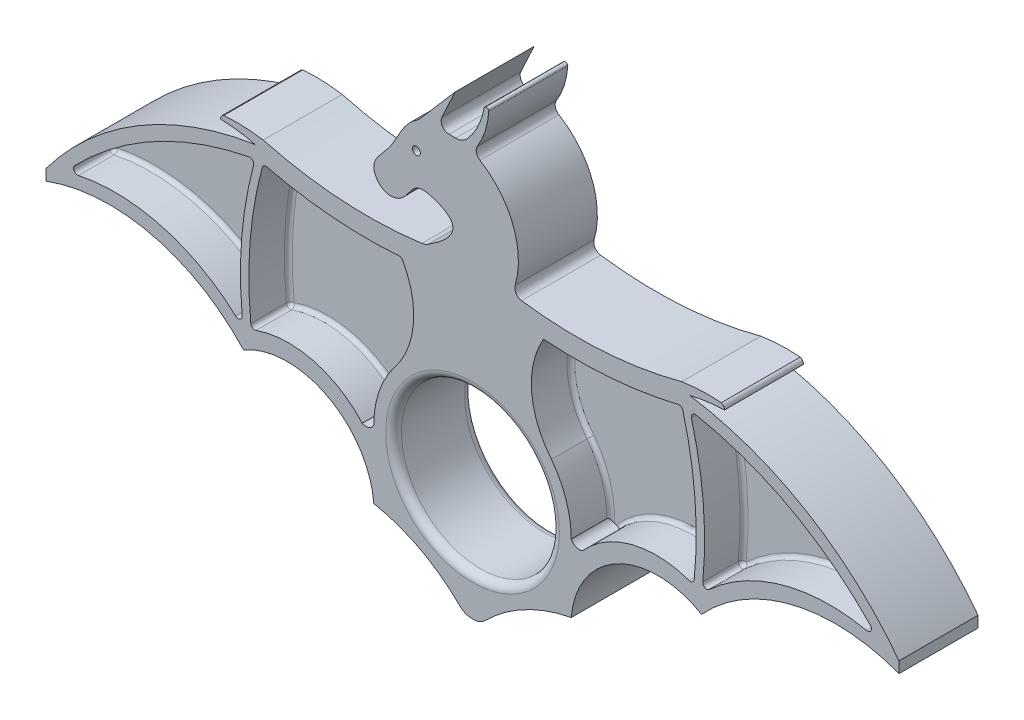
SolidWorks part; units mm, degrees
ref_plane "Front Plane" through (0, 0, 0) normal (0, 0, 1) x (1, 0, 0)
ref_plane "Top Plane" through (0, 0, 0) normal (0, 1, 0) x (1, 0, 0)
ref_plane "Right Plane" through (0, 0, 0) normal (1, 0, 0) x (0, 0, -1)
sketch "Sketch1" plane through (0, 0, 0) normal (0, 0, 1) x (1, 0, 0)
  line L0 (68.58, 0) -> (68.58, 76.2)
  line L1 (0, 0) -> (137.16, 0)
  line L2 (0, 0) -> (0, 76.2)
  line L3 (0, 76.2) -> (137.16, 76.2)
  line L4 (137.16, 0) -> (137.16, 76.2)
  line L5 (84.455, 19.05) -> (84.455, 0)
  line L6 (105.41, 76.2) -> (105.41, 0)
  line L7 (59.8445, 65.0965) -> (65.786, 71.9835)
  line L8 (103.505, 46.5545) -> (102.235, 46.5545)
  line L9 (103.505, 46.5545) -> (103.505, 48.5865)
  line L10 (103.505, 48.5865) -> (102.235, 48.5865)
  line L11 (102.235, 46.5545) -> (102.235, 48.5865)
  line L12 (102.235, 48.5865) -> (103.505, 48.5865)
  line L13 (102.235, 48.5865) -> (102.235, 49.8565)
  line L14 (102.235, 49.8565) -> (103.505, 49.8565)
  line L15 (103.505, 48.5865) -> (103.505, 49.8565)
  line L16 (65.786, 71.9835) -> (62.8153, 65.6045)
  line L17 (62.8153, 65.6045) -> (66.9565, 65.6045)
  line L18 (52.705, 19.05) -> (52.705, 15.8526)
  circle A0 centre (68.58, 19.05) radius 12.7
  circle A1 centre (68.58, 19.05) radius 15.875
  arc A2 (69.85, 0) -> (84.455, 8.128) centre (89.4686, -18.0665) cw
  arc A3 (84.455, 8.128) -> (105.41, 19.05) centre (98.3777, 6.9791) cw
  arc A4 (84.455, 15.8526) -> (105.41, 21.9165) centre (98.1556, 7.7465) cw
  arc A5 (105.41, 19.05) -> (137.16, 26.67) centre (126.9377, -0.6929) cw
  arc A6 (105.41, 21.9165) -> (137.16, 28.448) centre (126.0581, 1.98) cw
  arc A7 (137.16, 28.448) -> (103.505, 48.5865) centre (95.7139, -2.6247) ccw
  arc A8 (103.505, 46.5545) -> (133.985, 29.5657) centre (94.5213, -5.4001) cw
  arc A9 (103.505, 46.5545) -> (105.41, 21.9165) centre (44.6179, 29.6087) cw
  arc A10 (102.235, 46.5545) -> (104.14, 22.4978) centre (41.8613, 29.6699) cw
  arc A11 (102.235, 49.8565) -> (108.5799, 50.1105) centre (106.469, 23.4659) cw
  arc A12 (103.505, 48.5865) -> (109.093, 49.3485) centre (109.7334, 23.7821) cw
  arc A13 (108.5799, 50.1105) -> (109.093, 49.3485) centre (108.3321, 49.3899) cw
  arc A14 (102.235, 49.8565) -> (68.58, 49.8565) centre (85.4075, 112.5916) cw
  arc A15 (102.235, 46.5545) -> (68.58, 46.5545) centre (85.4075, 113.3765) cw
  arc A16 (81.28, 28.575) -> (80.01, 44.68) centre (92.0078, 37.5235) cw
  arc A17 (55.88, 28.575) -> (57.15, 44.68) centre (45.1522, 37.5235) ccw
  arc A18 (67.31, 0) -> (52.705, 8.128) centre (47.6914, -18.0665) ccw
  arc A19 (52.705, 8.128) -> (31.75, 19.05) centre (38.7823, 6.9791) ccw
  arc A20 (52.705, 15.8526) -> (31.75, 21.9165) centre (39.0044, 7.7465) ccw
  arc A21 (31.75, 19.05) -> (0, 26.67) centre (10.2223, -0.6929) ccw
  arc A22 (31.75, 21.9165) -> (0, 28.448) centre (11.1019, 1.98) ccw
  arc A23 (34.925, 46.5545) -> (33.02, 22.4978) centre (95.2987, 29.6699) ccw
  arc A24 (33.655, 46.5545) -> (31.75, 21.9165) centre (92.5421, 29.6087) ccw
  arc A25 (33.655, 46.5545) -> (3.175, 29.5657) centre (42.6387, -5.4001) ccw
  arc A26 (0, 28.448) -> (33.655, 48.5865) centre (41.4461, -2.6247) cw
  arc A27 (33.655, 48.5865) -> (28.067, 49.3485) centre (27.4266, 23.7821) ccw
  arc A28 (28.5801, 50.1105) -> (28.067, 49.3485) centre (28.8279, 49.3899) ccw
  arc A29 (34.925, 49.8565) -> (28.5801, 50.1105) centre (30.691, 23.4659) ccw
  arc A30 (34.925, 46.5545) -> (68.58, 46.5545) centre (51.7525, 113.3765) ccw
  arc A31 (34.925, 49.8565) -> (68.58, 49.8565) centre (51.7525, 112.5916) ccw
  arc A32 (74.93, 48.4895) -> (68.58, 65.0965) centre (63.1832, 53.5154) ccw
  arc A33 (68.58, 65.0965) -> (71.1962, 71.9835) centre (58.8616, 72.7287) ccw
  arc A34 (66.9565, 65.6045) -> (70.4342, 71.9835) centre (58.7382, 74.2224) ccw
  arc A35 (70.4342, 71.9835) -> (71.1962, 71.9835) centre (70.8152, 71.9835) cw
  circle A36 centre (59.5598, 60.678) radius 0.635
  arc A37 (86.3066, 18.3774) -> (84.455, 19.05) centre (85.7171, 19.6395) cw
  arc A38 (50.8534, 18.3774) -> (52.705, 19.05) centre (51.4429, 19.6395) ccw
  spline S0 degree 2 poles (60.96, 48.2948) (69.6217, 53.5349) (61.468, 55.6686) knots 0 0 0 1 1 1
  spline S1 degree 3 poles (61.468, 55.6686) (58.8768, 56.2608) (58.4711, 52.8685) (54.2924, 51.8809) (51.6267, 55.4286) (56.5362, 59.5219) (57.1373, 63.5085) (59.8445, 65.0965) knots 0 0 0 0 0.225896 0.335052 0.466531 0.65053 1 1 1 1
  point P49 (68.58, 38.1)
  dimension "D3" = 25.4
  dimension "D5" = 31.75
  dimension "D6" = 1.27
  dimension "D8" = 26.67
  dimension "D10" = 19.05
  dimension "D11" = 13.97
  dimension "D12" = 16.51
  dimension "D14" = 15.919
  dimension "D15" = 7.62
  dimension "D16" = 29.21
  dimension "D17" = 28.702
  dimension "D18" = 1.905
  dimension "D20" = 51.8005
  dimension "D22" = 3.175
  dimension "D25" = 52.7256
  dimension "D26" = 1.27
  dimension "D27" = 1.27
  dimension "D28" = 62.6903
  dimension "D29" = 61.2768
  dimension "D33" = 6.35
  dimension "D34" = 5.588
  dimension "D37" = 25.5744
  dimension "D38" = 26.7281
  dimension "D39" = 0.762
  dimension "D40" = 3.302
  dimension "D41" = 68.9083
  dimension "D44" = 12.7
  dimension "D46" = 13.97
  dimension "D42" = 64.9528
  dimension "D47" = 12.7768
  dimension "D50" = 0.508
  dimension "D55" = 0.381
  dimension "D57" = 11.9083
  dimension "D58" = 12.3571
  dimension "D63" = 1.27
  dimension "D1" = 137.16
  dimension "D2" = 76.2
  dimension "D4" = 19.05
  dimension "D7" = 8.128
  dimension "D9" = 31.75
  dimension "D13" = 16.51
  dimension "D19" = 1.778
  dimension "D21" = 26.67
  dimension "D23" = 0
  dimension "D24" = 2.032
  dimension "D30" = 1.27
  dimension "D31" = 1.27
  dimension "D32" = 2.032
  dimension "D35" = 0.762
  dimension "D36" = 0.254
  dimension "D43" = 8.4545
  dimension "D45" = 11.43
  dimension "D48" = 6.35
  dimension "D49" = 15.24
  dimension "D51" = 0
  dimension "D52" = 2.6162
  dimension "D53" = 1.8542
  dimension "D54" = 4.2165
  dimension "D56" = 1.6235
  dimension "D59" = 7.62
  dimension "D60" = 3.302
  dimension "D61" = 7.112
  dimension "D62" = 7.112
extrude "Boss-Extrude1" add sketch "Sketch1" along normal blind 12.7 contours A31 A29 A28 A27 A26 A22 A25 A24 A20 A23 A30 L0 | A20 A22 L2 A21 A19 A18 L1 L0 A1 L18 | A38 A20 L18 | A17 A1 L0 A0 | A1 A16 L0 A0 | L1 A2 L5 A1 L0 | A4 A37 L5 | A4 L5 A3 L6 | A6 L6 A5 L4 | L6 A8 A6 A7 | L8 A10 A4 L6 A9 | A9 L6 | L10 L15 L14 L13 | L15 A12 L6 A11 L14 | L11 L8 L9 L10 | L9 A8 L6 A7 | A15 L11 L13 A14 L0 | A30 A17 A1 L0 | A1 A16 A15 L0 | S1 S0 A31 L0 A34 L17 L16 L7 A36 | A14 A32 L0 | A35 A34 L0 A33 | A13 A11 L6 A12
sketch "Sketch2" plane through (0, 0, 0) normal (0, 0, -1) x (-1, 0, 0)
  arc A0 (-57.15, 44.68) -> (-34.925, 46.5545) centre (-51.7525, 113.3765) ccw
  arc A1 (-33.02, 22.4978) -> (-34.925, 46.5545) centre (-95.2987, 29.6699) ccw
  arc A2 (-50.8534, 18.3774) -> (-33.02, 22.4978) centre (-39.0044, 7.7465) cw
  arc A3 (-52.705, 19.05) -> (-50.8534, 18.3774) centre (-51.4429, 19.6395) ccw
  arc A4 (-52.705, 19.05) -> (-55.88, 28.575) centre (-68.58, 19.05) ccw
  arc A5 (-55.88, 28.575) -> (-57.15, 44.68) centre (-45.1522, 37.5235) cw
  arc A6 (-33.655, 46.5545) -> (-3.175, 29.5657) centre (-42.6387, -5.4001) cw
  arc A7 (-31.75, 21.9165) -> (-3.175, 29.5657) centre (-11.1019, 1.98) cw
  arc A8 (-31.75, 21.9165) -> (-33.655, 46.5545) centre (-92.5421, 29.6087) ccw
  arc A9 (-102.235, 46.5545) -> (-80.01, 44.68) centre (-85.4075, 113.3765) ccw
  arc A10 (-80.01, 44.68) -> (-81.28, 28.575) centre (-92.0078, 37.5235) cw
  arc A11 (-84.455, 19.05) -> (-81.28, 28.575) centre (-68.58, 19.05) cw
  arc A12 (-86.3066, 18.3774) -> (-84.455, 19.05) centre (-85.7171, 19.6395) ccw
  arc A13 (-86.3066, 18.3774) -> (-104.14, 22.4978) centre (-98.1556, 7.7465) ccw
  arc A14 (-104.14, 22.4978) -> (-102.235, 46.5545) centre (-41.8613, 29.6699) cw
  arc A15 (-103.505, 46.5545) -> (-133.985, 29.5657) centre (-94.5213, -5.4001) ccw
  arc A16 (-133.985, 29.5657) -> (-105.41, 21.9165) centre (-126.0581, 1.98) cw
  arc A17 (-105.41, 21.9165) -> (-103.505, 46.5545) centre (-44.6179, 29.6087) cw
extrude "Boss-Extrude2" add sketch "Sketch2" against normal blind 6.35
fillet "Fillet2" radius 2.54 2 edges at (69.85, 0, 6.35) (67.31, 0, 6.35)
fillet "Fillet3" radius 1.27 3 edges at (74.93, 48.4895, 6.35) (62.8153, 65.6045, 6.35) (68.58, 65.0965, 6.35)
fillet "Fillet4" radius 2.54 2 edges at (59.8445, 65.0965, 6.35) (66.9565, 65.6045, 6.35)
fillet "Fillet6" radius 2.54 1 edges at (60.96, 48.2948, 6.35)
fillet "Fillet7" radius 0.635 11 edges at (133.985, 29.5657, 9.525) (105.41, 21.9165, 9.525) (104.14, 22.4978, 9.525) (103.505, 46.5545, 9.525) (102.235, 46.5545, 9.525) (3.175, 29.5657, 9.525) (57.15, 44.68, 9.525) (33.02, 22.4978, 9.525) (34.925, 46.5545, 9.525) (33.655, 46.5545, 9.525) (31.75, 21.9165, 9.525)
fillet "Fillet8" radius 0.635 24 edges at (132.6373, 30.3841, 6.35) (119.705, 40.9224, 6.35) (103.9242, 46.1795, 6.35) (105.6821, 34.7092, 6.35) (105.9548, 23.0415, 6.35) (90.8918, 44.6869, 6.35) (102.1102, 46.3358, 6.35) (104.3479, 34.7189, 6.35) (103.9382, 22.845, 6.35) (31.2052, 23.0415, 6.35) (31.4779, 34.7092, 6.35) (33.2358, 46.1795, 6.35) (17.455, 40.9224, 6.35) (4.5227, 30.3841, 6.35) (42.9782, 23.1616, 6.35) (33.2218, 22.845, 6.35) (46.0701, 44.703, 6.35) (35.0498, 46.3358, 6.35) (118.4721, 29.6614, 6.35) (83.6403, 24.0701, 6.35) (78.081, 36.4253, 6.35) (94.1818, 23.1616, 6.35) (18.6879, 29.6614, 6.35) (32.8121, 34.7189, 6.35)
fillet "Fillet9" radius 1.27 2 edges at (81.28, 19.05, 12.7) (81.28, 19.05, 0)
